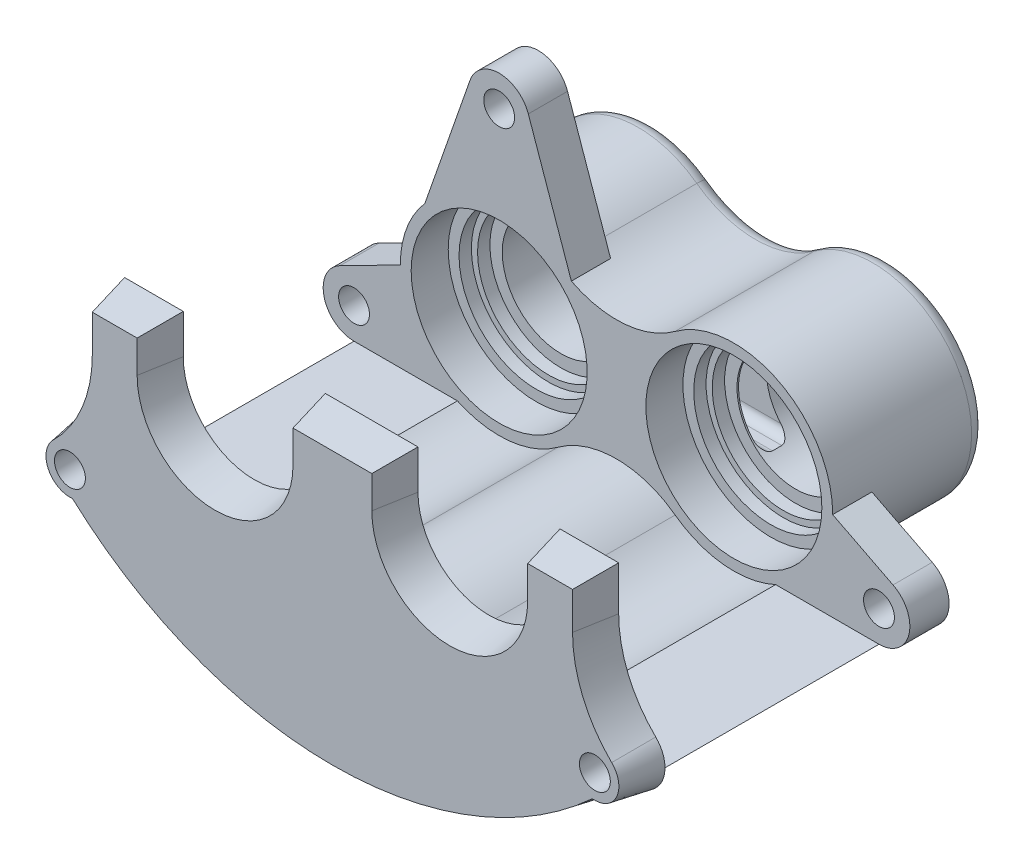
SolidWorks part; units mm, degrees
ref_plane "Front Plane" through (0, 0, 0) normal (0, 0, 1) x (1, 0, 0)
ref_plane "Top Plane" through (0, 0, 0) normal (0, 1, 0) x (1, 0, 0)
ref_plane "Right Plane" through (0, 0, 0) normal (1, 0, 0) x (0, 0, -1)
sketch "Sketch1" plane through (0, 0, 0) normal (0, 0, 1) x (1, 0, 0)
  line L0 (-19, 0) -> (0, 0) construction
  line L1 (0, 0) -> (0, 25.7488) construction
  arc A0 (-9.5, 12.8744) -> (-9.5, -12.8744) centre (-19, 0) ccw
  arc A1 (-9.5, 12.8744) -> (9.5, 12.8744) centre (0, 25.7488) ccw
  arc A2 (9.5, 12.8744) -> (9.5, -12.8744) centre (19, 0) cw
  arc A3 (-9.5, -12.8744) -> (9.5, -12.8744) centre (0, -25.7488) cw
  dimension "D1" = 38
  dimension "D2" = 16
extrude "Boss-Extrude1" add sketch "Sketch1" along normal mid plane 25
ref_plane "Plane1" through (19, 0, 0) normal (1, 0, 0) x (0, 0, -1)
sketch "Sketch2" plane through (19, 0, 0) normal (1, 0, 0) x (0, 0, -1)
  line L0 (-18.0558, 0) -> (18.0558, 0) construction
  line L1 (-12.5, 14.25) -> (-6.5, 14.25)
  line L2 (-12.5, 16) -> (-12.5, -16) construction
  line L3 (-6.5, 14.25) -> (-6.5, 12.5)
  line L4 (-6.5, 12.5) -> (-4.5, 12.5)
  line L5 (-4.5, 12.5) -> (-4.5, 11.5)
  line L6 (-4.5, 11.5) -> (-2.5, 11.5)
  line L7 (-2.5, 11.5) -> (-2.5, 9.5)
  line L8 (-2.5, 9.5) -> (9.5, 9.5)
  line L9 (9.5, 9.5) -> (9.5, 4.5)
  line L10 (9.5, 4.5) -> (8.5, 4.5)
  line L11 (8.5, 4.5) -> (8.5, 0)
  line L12 (8.5, 0) -> (-12.5, 0)
  line L13 (-12.5, 14.25) -> (-12.5, 0)
  point P4 (0, 0)
  dimension "D1" = 28.5
  dimension "D2" = 6
  dimension "D3" = 2
  dimension "D4" = 2
  dimension "D5" = 22
  dimension "D6" = 9
  dimension "D7" = 21
  dimension "D8" = 19
  dimension "D9" = 23
  dimension "D10" = 25
revolve "Cut-Revolve1" cut sketch "Sketch2" angle 360 about L0
mirror "Mirror1" about plane through (0, 0, 0) normal (1, 0, 0) of "Cut-Revolve1"
sketch "Sketch3" plane through (0, 0, 0) normal (1, 0, 0) x (0, 0, -1)
  line L3 (-0.75, 7.75) -> (0.75, 7.75)
  line L4 (-2.25, 6.25) -> (-2.25, -6.25)
  line L5 (-0.75, -7.75) -> (0.75, -7.75)
  line L6 (2.25, 6.25) -> (2.25, -6.25)
  line L7 (-2.25, 7.75) -> (2.25, -7.75) construction
  line L8 (-2.25, -7.75) -> (2.25, 7.75) construction
  arc A2 (0.75, -7.75) -> (2.25, -6.25) centre (0.75, -6.25) ccw
  arc A3 (-2.25, -6.25) -> (-0.75, -7.75) centre (-0.75, -6.25) ccw
  arc A4 (-0.75, 7.75) -> (-2.25, 6.25) centre (-0.75, 6.25) ccw
  arc A5 (0.75, 7.75) -> (2.25, 6.25) centre (0.75, 6.25) cw
  point P0 (0, 0)
  dimension "D1" = 1.5
  dimension "D2" = 12.5
  dimension "D3" = 1.5
extrude "Cut-Extrude1" cut sketch "Sketch3" against normal up to surface and the other way up to surface
sketch "Sketch4" plane through (0, 0, 12.5) normal (0, 0, 1) x (1, 0, 0)
  line L0 (-34.9999, -0.0669) -> (-44.77, -5.045)
  line L1 (-42.5, -14.5) -> (-25.7639, -14.5)
  arc A0 (-9.5, 12.8744) -> (-9.5, -12.8744) centre (-19, 0) ccw construction
  arc A1 (-44.77, -5.045) -> (-42.5, -14.5) centre (-42.5, -9.5) ccw
  circle A2 centre (-19, 0) radius 4.5 construction
  arc A3 (-34.9999, -0.0669) -> (-25.7639, -14.5) centre (-19, 0) ccw
  dimension "D1" = 27
  dimension "D2" = 23.5
  dimension "D3" = 9.5
  dimension "D4" = 5
extrude "Boss-Extrude2" add sketch "Sketch4" against normal blind 6.35
mirror "Mirror2" about plane through (0, 0, 0) normal (1, 0, 0) of "Boss-Extrude2"
sketch "Sketch5" plane through (0, 0, 12.5) normal (0, 0, 1) x (1, 0, 0)
  line L0 (-19, 16) -> (-19, 29.8287) construction
  line L1 (-31.0282, 10.5509) -> (-23.7204, 31.4772)
  line L2 (-7.3087, 11.5156) -> (-14.2796, 31.4772)
  line L3 (42.5, -9.5) -> (-19, 29.8287) construction
  arc A0 (-14.2796, 31.4772) -> (-23.7204, 31.4772) centre (-19, 29.8287) ccw
  arc A1 (-9.5, 12.8744) -> (-34.9999, -0.0669) centre (-19, 0) ccw construction
  circle A2 centre (-19, 29.8287) radius 2.5
  arc A3 (-9.5, 12.8744) -> (-31.0282, 10.5509) centre (-19, 0) ccw
  arc A4 (-9.5, 12.8744) -> (9.5, 12.8744) centre (0, 25.7488) ccw construction
  arc A5 (-9.5, 12.8744) -> (-7.3087, 11.5156) centre (0, 25.7488) ccw
  dimension "D1" = 38.5
  dimension "D3" = 5
  dimension "D4" = 5
  dimension "D2" = 19.25
  dimension "D5" = 73
extrude "Boss-Extrude3" add sketch "Sketch5" against normal blind 6.35
sketch "Sketch6" plane through (0, 0, 6.15) normal (0, 0, -1) x (-1, 0, 0)
  line L0 (42.5, -14.5) -> (25.7639, -14.5) construction
  line L1 (-42.5, -14.5) -> (-25.7639, -14.5) construction
  line L2 (42.5, -14.5) -> (25.7639, -14.5)
  line L3 (-42.5, -14.5) -> (-25.7639, -14.5)
  arc A0 (-42.5, -14.5) -> (42.5, -14.5) centre (0, 32.6805) ccw
  arc A1 (9.5, -12.8744) -> (9.5, 12.8744) centre (19, 0) ccw construction
  arc A2 (9.5, -12.8744) -> (-9.5, -12.8744) centre (0, -25.7488) ccw construction
  arc A3 (-9.5, 12.8744) -> (-9.5, -12.8744) centre (-19, 0) ccw construction
  arc A4 (9.5, -12.8744) -> (25.7639, -14.5) centre (19, 0) ccw
  arc A5 (9.5, -12.8744) -> (-9.5, -12.8744) centre (0, -25.7488) ccw
  arc A6 (-25.7639, -14.5) -> (-9.5, -12.8744) centre (-19, 0) ccw
  dimension "D1" = 63.5
extrude "Boss-Extrude4" add sketch "Sketch6" against normal blind 46
sketch "Sketch7" plane through (0, 0, 52.15) normal (0, 0, 1) x (1, 0, 0)
  line L0 (-40, 8.3536) -> (-40, 15.5)
  line L1 (-40, 15.5) -> (-30.5, 15.5)
  line L2 (-30.5, 15.5) -> (-30.5, 9.15)
  line L3 (-7.5, 9.15) -> (-7.5, 15.5)
  line L4 (-7.5, 15.5) -> (7.5, 15.5)
  line L5 (0, 0) -> (0, 15.5) construction
  line L6 (7.5, 9.15) -> (7.5, 15.5)
  line L7 (30.5, 15.5) -> (30.5, 9.15)
  line L8 (40, 15.5) -> (30.5, 15.5)
  line L10 (40, 15.5) -> (40, 8.3536)
  arc A0 (42.5, -14.5) -> (44.77, -5.045) centre (42.5, -9.5) ccw construction
  arc A1 (-44.77, -5.045) -> (-42.5, -14.5) centre (-42.5, -9.5) ccw construction
  arc A2 (-42.5, -14.5) -> (42.5, -14.5) centre (0, 32.6805) ccw construction
  arc A3 (42.5, -14.5) -> (46, -5.9293) centre (42.5, -9.5) ccw
  arc A5 (-42.5, -14.5) -> (42.5, -14.5) centre (0, 32.6805) ccw
  arc A7 (-30.5, 9.15) -> (-7.5, 9.15) centre (-19, 9.15) ccw
  arc A8 (30.5, 9.15) -> (7.5, 9.15) centre (19, 9.15) cw
  arc A17 (-46, -5.9293) -> (-42.5, -14.5) centre (-42.5, -9.5) ccw
  arc A18 (-46, -5.9293) -> (-40, 8.3536) centre (-60, 8.3536) ccw
  arc A19 (46, -5.9293) -> (40, 8.3536) centre (60, 8.3536) cw
  point P14 (0, 15.5)
  dimension "D1" = 80
  dimension "D5" = 6.35
  dimension "D6" = 20
  dimension "D2" = 15
  dimension "D3" = 9.5
  dimension "D4" = 25
extrude "Boss-Extrude5" add sketch "Sketch7" along normal blind 6.35 draft 10
other "Hole1"
sketch "Sketch8" plane through (0, 0, 58.5) normal (0, 0, 1) x (1, 0, 0)
  circle A0 centre (42.5, -9.5) radius 2.5
  arc A1 (42.0915, -13.3588) -> (45.2162, -6.7289) centre (42.5, -9.5) ccw construction
  dimension "D1" = 5
mirror "Mirror4" about plane through (0, 0, 0) normal (1, 0, 0) of "Hole1"
fillet "Fillet1" radius 2.5 4 edges at (0, -9.7488, -12.5) (-35, 0, -12.5) (0, 9.7488, -12.5) (35, 0, -12.5)
